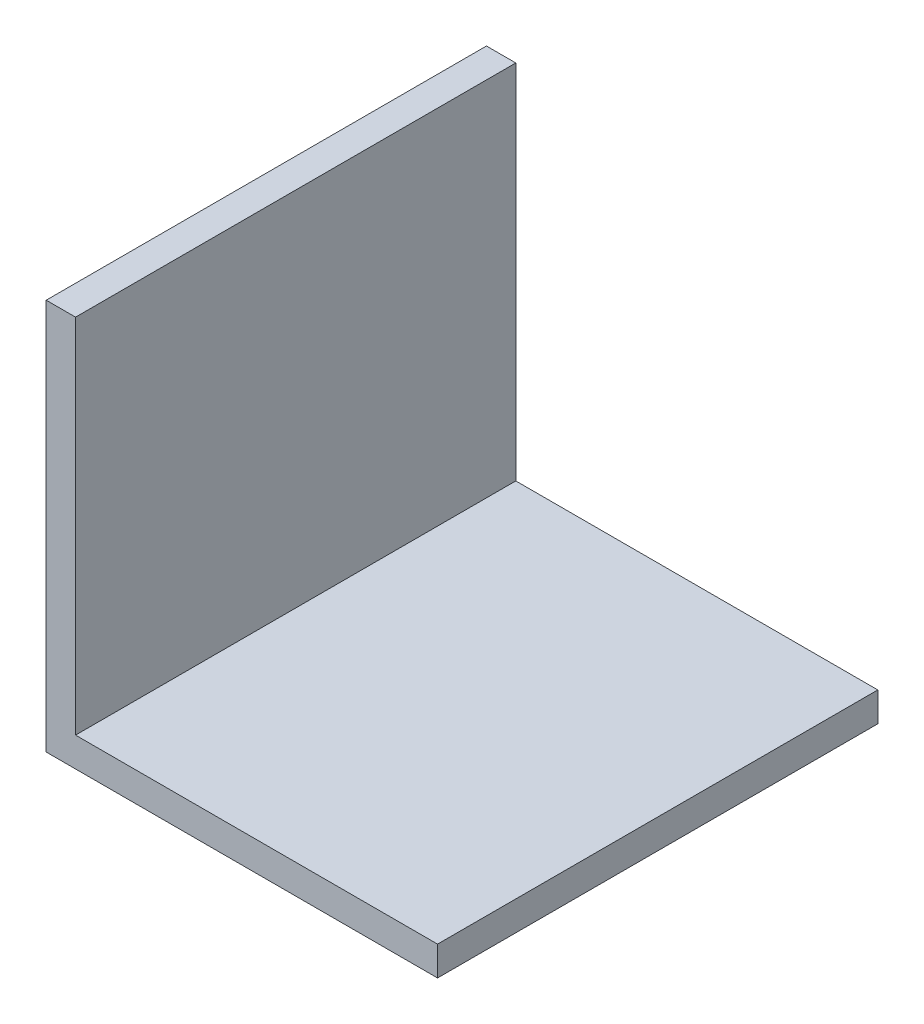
SolidWorks part; units mm, degrees
ref_plane "Plan de face" through (0, 0, 0) normal (0, 0, 1) x (1, 0, 0)
ref_plane "Plan de dessus" through (0, 0, 0) normal (0, 1, 0) x (1, 0, 0)
ref_plane "Plan de droite" through (0, 0, 0) normal (1, 0, 0) x (0, 0, -1)
sketch "Esquisse1" plane through (0, 0, 0) normal (0, 0, 1) x (1, 0, 0)
  line L0 (0, 0) -> (80, 0)
  line L1 (80, 0) -> (80, 6)
  line L2 (80, 6) -> (6, 6)
  line L3 (6, 6) -> (6, 80)
  line L4 (0, 0) -> (0, 80)
  line L5 (0, 80) -> (6, 80)
  dimension "D1" = 80
  dimension "D2" = 80
  dimension "D3" = 6
  dimension "D4" = 6
extrude "Extrusion1" add sketch "Esquisse1" along normal blind 90
ref_plane "Plan1" through (0, 0, 45) normal (0, 0, -1) x (-1, 0, 0)
